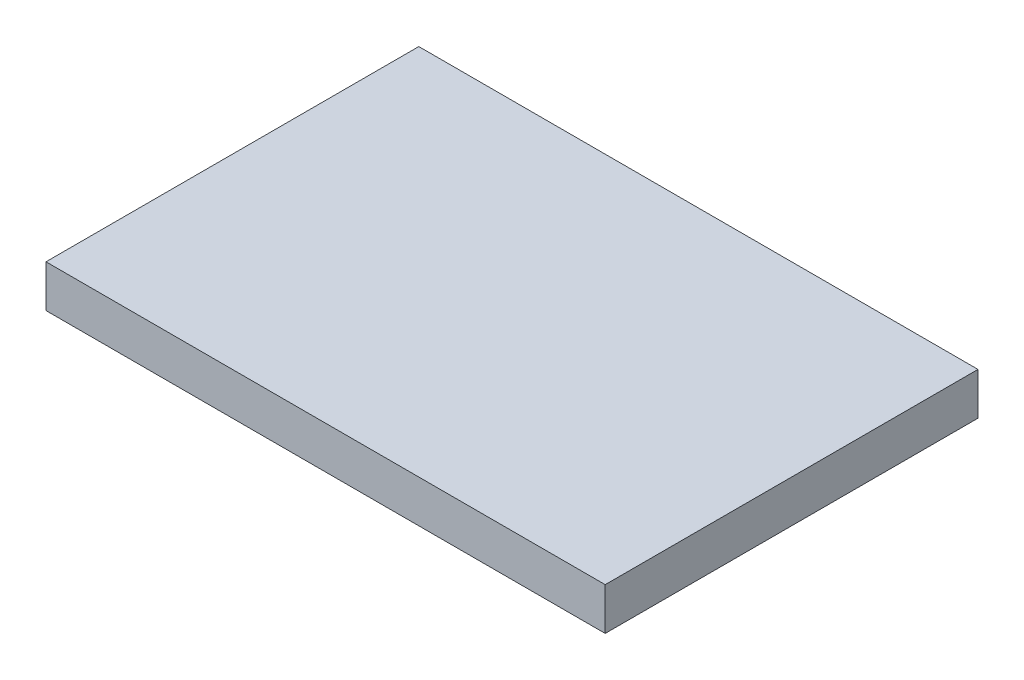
SolidWorks part; units mm, degrees
ref_plane "Front Plane" through (0, 0, 0) normal (0, 0, 1) x (1, 0, 0)
ref_plane "Top Plane" through (0, 0, 0) normal (0, 1, 0) x (1, 0, 0)
ref_plane "Right Plane" through (0, 0, 0) normal (1, 0, 0) x (0, 0, -1)
sketch "Sketch1" plane through (0, 0, 0) normal (0, 1, 0) x (1, 0, 0)
  line L1 (0, 0) -> (84, 0)
  line L2 (0, 0) -> (0, 56)
  line L3 (0, 56) -> (84, 56)
  line L4 (84, 0) -> (84, 56)
  dimension "D1" = 56
  dimension "D2" = 84
extrude "Boss-Extrude1" add sketch "Sketch1" along normal blind 6.35
